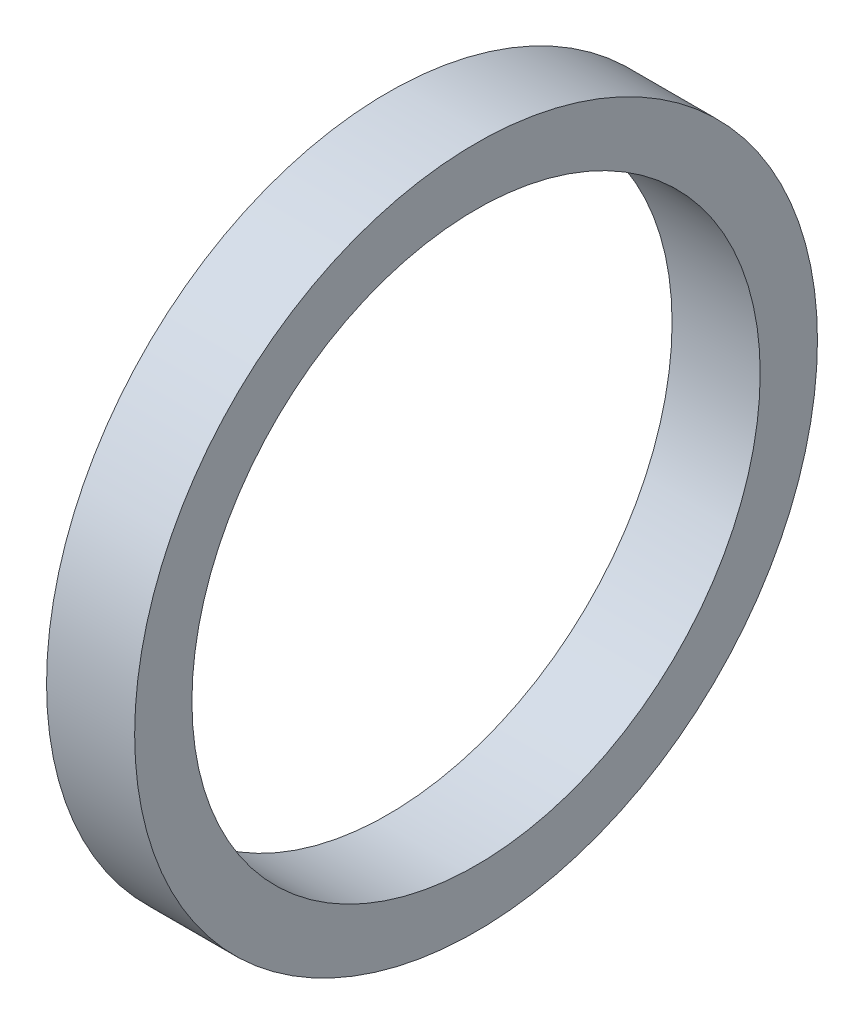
SolidWorks part; units mm, degrees
ref_plane "Plan1" through (0, 0, 0) normal (0, 0, 1) x (1, 0, 0)
ref_plane "Plan2" through (0, 0, 0) normal (0, 1, 0) x (1, 0, 0)
ref_plane "Plan3" through (0, 0, 0) normal (1, 0, 0) x (0, 0, -1)
sketch "Esquisse1" plane through (0, 0, 0) normal (0, 0, 1) x (1, 0, 0)
  line L0 (-17.3584, 0) -> (33.4945, 0) construction
  line L1 (50, 0) -> (-50, 0) construction
  line L2 (0, 15.5) -> (4, 15.5)
  line L3 (0, 15.5) -> (0, 12.9)
  line L4 (0, 12.9) -> (4, 12.9)
  line L5 (4, 15.5) -> (4, 12.9)
  line L6 (0, -50) -> (0, 50) construction
  dimension "D1" = 25.8
  dimension "D2" = 31
  dimension "D3" = 4
revolve "Révolution1" add sketch "Esquisse1" angle 360 about L0
